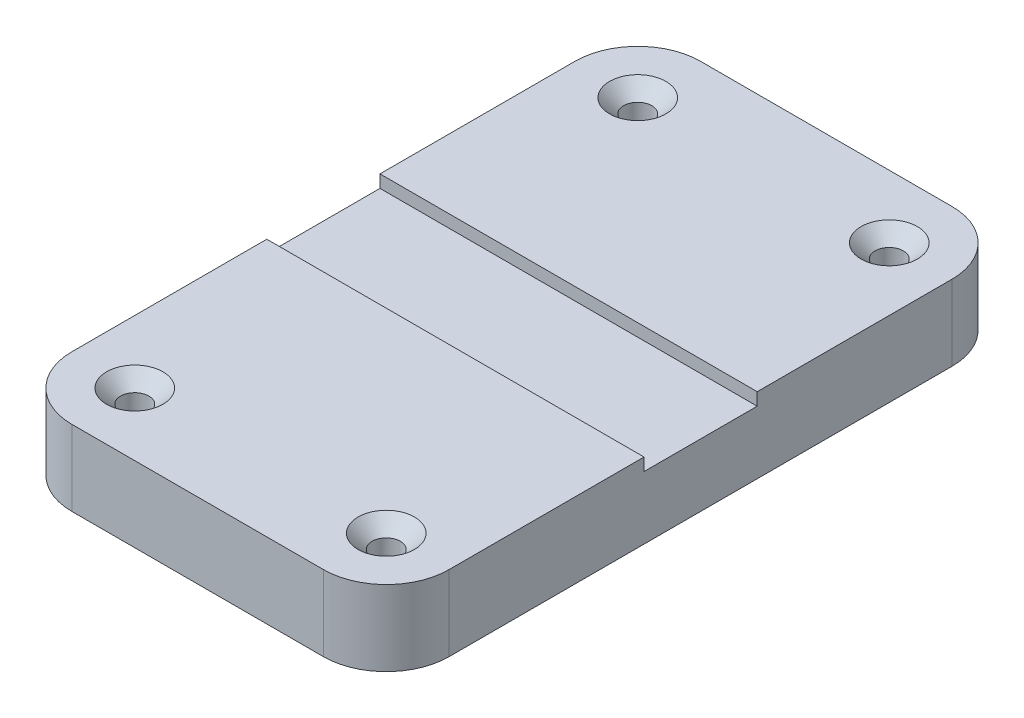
SolidWorks part; units mm, degrees
ref_plane "Front Plane" through (0, 0, 0) normal (0, 0, 1) x (1, 0, 0)
ref_plane "Top Plane" through (0, 0, 0) normal (0, 1, 0) x (1, 0, 0)
ref_plane "Right Plane" through (0, 0, 0) normal (1, 0, 0) x (0, 0, -1)
sketch "Sketch1" plane through (0, 0, 0) normal (0, 1, 0) x (1, 0, 0)
  line L1 (0, 0) -> (60, 0)
  line L2 (0, 0) -> (0, 100)
  line L3 (0, 100) -> (60, 100)
  line L4 (60, 0) -> (60, 100)
  dimension "D1" = 60
  dimension "D2" = 100
extrude "Boss-Extrude1" add sketch "Sketch1" along normal blind 12
sketch "Sketch2" plane through (0, 12, 0) normal (0, 1, 0) x (1, 0, 0)
  line L0 (0, 100) -> (0, 0) construction
  line L1 (0, 59) -> (60, 59)
  line L2 (0, 59) -> (0, 41)
  line L3 (0, 41) -> (60, 41)
  line L4 (60, 59) -> (60, 41)
  line L5 (60, 0) -> (60, 100) construction
  line L6 (-6.6, 0) -> (6.6, 0) construction
  dimension "D1" = 18
  dimension "D2" = 41
extrude "Cut-Extrude1" cut sketch "Sketch2" against normal blind 2
fillet "Fillet1" radius 10 4 edges at (0, 6, 0) (60, 6, 0) (0, 6, -100) (60, 6, -100)
hole_wizard "CSK for M4 SFHCS1" positions "Sketch4" profile "Sketch3" countersink size "M4" standard "ANSI Metric"
sketch "Sketch4" plane through (0, 12, 0) normal (0, 1, 0) x (1, 0, 0)
  line L0 (0, -6.6) -> (0, 6.6) construction
  line L1 (50, 100) -> (10, 100) construction
  line L2 (60, 59) -> (60, 90) construction
  line L3 (-6.6, 0) -> (6.6, 0) construction
  point P0 (10, 10)
  point P2 (50, 10)
  point P4 (10, 90)
  point P6 (50, 90)
  dimension "D1" = 10
  dimension "D2" = 10
  dimension "D3" = 10
  dimension "D4" = 10
sketch "Sketch3" plane through (10, 12, -10) normal (1, 0, 0) x (0, 0, 1)
  line L0 (0, 0) -> (0, 12)
  line L1 (0, 12) -> (2.25, 12)
  line L2 (2.25, 12) -> (2.25, 2.23)
  line L3 (2.25, 2.23) -> (4.48, 0)
  line L5 (4.48, 0) -> (0, 0)
  line L6 (-2.25, 2.23) -> (-4.48, 0) construction
  line L11 (0, -6.35) -> (0, 107.95) construction
  dimension "Thru Hole Dia." = 4.5
  dimension "Thru Hole Depth" = 12
  dimension "Near C'Sink Dia." = 8.96
  dimension "Near C'Sink Angle" = 90
